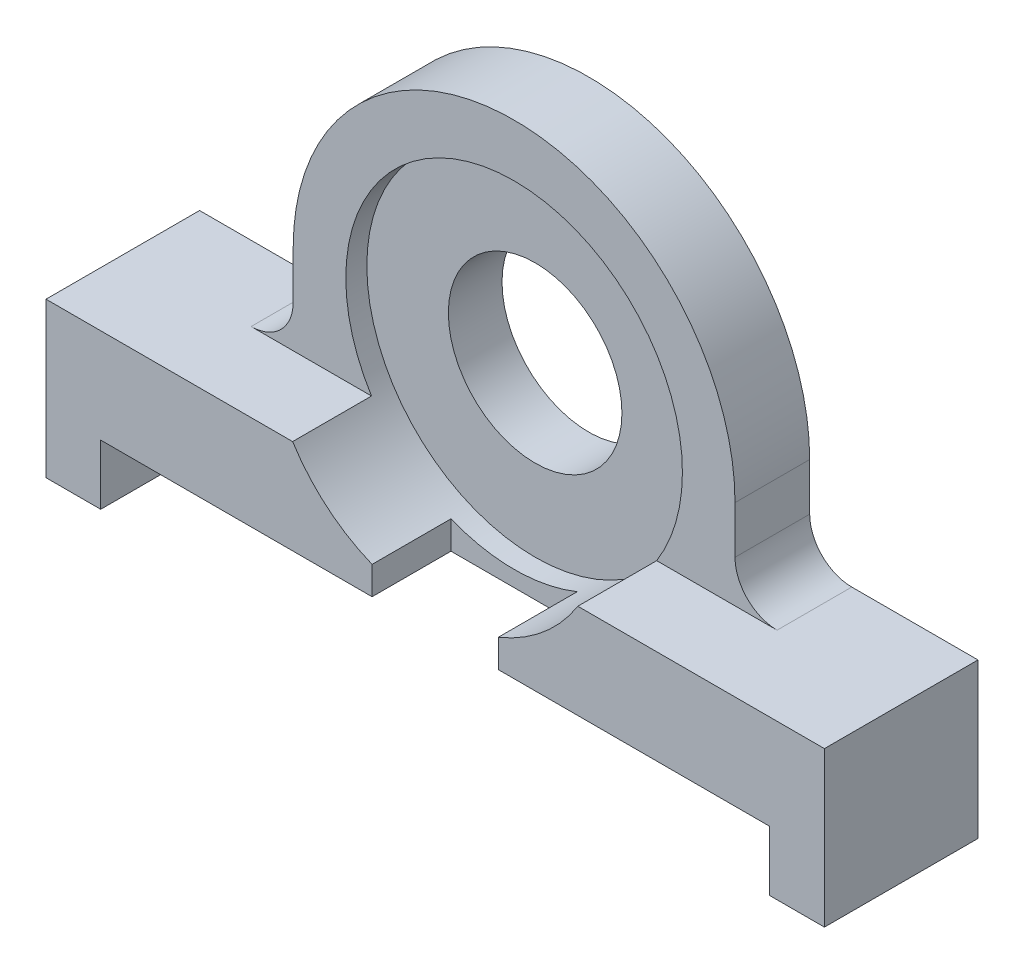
SolidWorks part; units mm, degrees
ref_plane "Front Plane" through (0, 0, 0) normal (0, 0, 1) x (1, 0, 0)
ref_plane "Top Plane" through (0, 0, 0) normal (0, 1, 0) x (1, 0, 0)
ref_plane "Right Plane" through (0, 0, 0) normal (1, 0, 0) x (0, 0, -1)
sketch "Sketch2" plane through (0, 0, 0) normal (0, 0, 1) x (1, 0, 0)
  line L0 (-21, 0) -> (21, 0)
  line L1 (-21, 14.7) -> (-21, 23.2)
  line L2 (21, 23.2) -> (21, 14.7)
  line L3 (21, 14.7) -> (37, 14.7)
  line L4 (37, 14.7) -> (37, 0)
  line L9 (37, 0) -> (21, 0)
  line L10 (0, 9.4378) -> (0, -16.7527) construction
  line L11 (-37, 0) -> (-21, 0)
  line L12 (-37, 14.7) -> (-37, 0)
  line L13 (-21, 14.7) -> (-37, 14.7)
  circle A1 centre (0, 23.2) radius 16
  arc A3 (-21, 23.2) -> (21, 23.2) centre (0, 23.2) cw
  point P2 (0, 44.2)
  point P7 (0, 0)
  point P8 (0, 0.9)
  point P10 (0, 7.2)
  point P12 (0, 39.2)
  dimension "D1" = 32
  dimension "D6" = 23.2
  dimension "D2" = 14.7
  dimension "D3" = 16
  dimension "D5" = 5
extrude "Boss-Extrude1" add sketch "Sketch2" along normal blind 12
sketch "Sketch3" plane through (0, 0, 0) normal (0, 0, 1) x (1, 0, 0)
  circle A1 centre (0, 23.2) radius 8.25
  circle A2 centre (0, 23.2) radius 16 construction
  circle A3 centre (0, 23.2) radius 16
  dimension "D1" = 16.5
extrude "Boss-Extrude2" add sketch "Sketch3" along normal blind 2.5
sketch "Sketch8" plane through (0, 0, 0) normal (0, 0, 1) x (1, 0, 0)
  line L1 (-27, 0) -> (27, 0)
  line L3 (-27, 10.55) -> (27, 10.55)
  line L4 (27, 7.2) -> (27, 10.55)
  line L5 (27, 7.2) -> (34.1, 7.2)
  line L6 (34.1, 7.2) -> (34.1, 0)
  line L7 (-37, 0) -> (37, 0) construction
  line L8 (0, 0) -> (0, 10.55) construction
  line L9 (26.9, 7) -> (33.9, 7) construction
  line L10 (33.9, 0) -> (33.9, 7) construction
  line L11 (24.9, 10.35) -> (-24.9, 10.35) construction
  line L12 (34.1, 0) -> (27, 0)
  line L13 (-34.1, 0) -> (-27, 0)
  line L14 (-34.1, 7.2) -> (-34.1, 0)
  line L15 (-27, 7.2) -> (-34.1, 7.2)
  line L16 (-27, 7.2) -> (-27, 10.55)
  point P6 (0, 10.55)
  dimension "D1" = 54
  dimension "D2" = 0.2
  dimension "D3" = 0.2
  dimension "D4" = 0.2
extrude "Cut-Extrude4" cut sketch "Sketch8" along normal blind 1
sketch "Sketch9" plane through (0, 0, 1) normal (0, 0, -1) x (-1, 0, 0)
  line L0 (-34.1, 0) -> (34.1, 0) construction
  line L1 (21.8, 0) -> (-21.8, 0)
  line L2 (21.8, 0) -> (21.8, 5.7)
  line L3 (21.8, 5.7) -> (-21.8, 5.7)
  line L4 (-21.8, 0) -> (-21.8, 5.7)
  line L5 (-27, 7.2) -> (-27, 10.55) construction
  point P6 (0, 5.7)
  dimension "D1" = 5.2
  dimension "D2" = 5.7
extrude "Cut-Extrude5" cut sketch "Sketch9" against normal up to next
sketch "Sketch10" plane through (0, 0, 0) normal (0, -1, 0) x (1, 0, 0)
  line L0 (-37, 12) -> (-21.8, 12) construction
  line L1 (-37, 12) -> (-37, 0) construction
  line L2 (0, 0) -> (0, 15.6223) construction
  line L3 (-37, 0) -> (-34.1, 0) construction
  circle A0 centre (-34, 9) radius 1.25
  circle A1 centre (-34, 3) radius 1.25
  circle A2 centre (34, 3) radius 1.25
  circle A3 centre (34, 9) radius 1.25
  dimension "D1" = 2.5
  dimension "D4" = 3
  dimension "D2" = 3
  dimension "D3" = 3
extrude "Cut-Extrude6" cut sketch "Sketch10" against normal blind 9
sketch "Sketch11" plane through (0, 0, 12) normal (0, 0, 1) x (1, 0, 0)
  line L0 (21, 14.7) -> (21, 23.2) construction
  line L1 (-21, 23.2) -> (-21, 14.7) construction
  line L2 (21, 14.7) -> (21, 23.2)
  line L3 (-21, 23.2) -> (-21, 14.7)
  line L4 (-21, 14.7) -> (21, 14.7)
  arc A0 (21, 23.2) -> (-21, 23.2) centre (0, 23.2) ccw construction
  arc A1 (21, 23.2) -> (-21, 23.2) centre (0, 23.2) ccw
extrude "Cut-Extrude7" cut sketch "Sketch11" against normal offset from surface (7.5 mm away) 2
fillet "Filete1" radius 2 2 edges at (27, 10.55, 0.5) (-27, 10.55, 0.5)
fillet "Filete2" radius 4 2 edges at (-21, 14.7, 2.25) (21, 14.7, 2.25)
sketch "Sketch12" plane through (0, 0, 12) normal (0, 0, 1) x (1, 0, 0)
  line L0 (21.8, 5.7) -> (-21.8, 5.7) construction
  line L1 (21.8, 0) -> (31.8, 0)
  line L2 (21.8, 0) -> (21.8, 5.7)
  line L3 (21.8, 5.7) -> (31.8, 5.7)
  line L4 (31.8, 0) -> (31.8, 5.7)
  line L5 (0, 0) -> (0, 5.354) construction
  line L6 (-31.8, 0) -> (-31.8, 5.7)
  line L7 (-21.8, 5.7) -> (-31.8, 5.7)
  line L8 (-21.8, 0) -> (-21.8, 5.7)
  line L9 (-21.8, 0) -> (-31.8, 0)
  dimension "D1" = 10
extrude "Cut-Extrude8" cut sketch "Sketch12" against normal blind 7
sketch "Sketch14" plane through (0, 0, 5) normal (0, 0, 1) x (1, 0, 0)
  line L1 (24.8, 1.35) -> (31.8, 1.35)
  line L2 (24.8, 1.35) -> (24.8, 4.35)
  line L3 (24.8, 4.35) -> (31.8, 4.35)
  line L4 (31.8, 1.35) -> (31.8, 4.35)
  line L5 (31.8, 0) -> (31.8, 5.7) construction
  line L6 (31.8, 0) -> (31.8, 5.7) construction
  line L7 (0, 0) -> (0, 5.8267) construction
  line L8 (-31.8, 1.35) -> (-31.8, 4.35)
  line L9 (-24.8, 4.35) -> (-31.8, 4.35)
  line L10 (-24.8, 1.35) -> (-24.8, 4.35)
  line L11 (-24.8, 1.35) -> (-31.8, 1.35)
  point P8 (31.8, 2.85)
  point P9 (-31.8, 2.85)
  dimension "D1" = 3
  dimension "D2" = 7
extrude "Cut-Extrude9" [suppressed] cut sketch "Sketch14" against normal blind 1.5
fillet "Fillet1" [suppressed] radius 1.5
sketch "Sketch15" plane through (0, 0, 12) normal (0, 0, 1) x (1, 0, 0)
  line L0 (31.8, 5.7) -> (-31.8, 5.7) construction
  line L1 (-6, 5.7) -> (6, 5.7)
  line L2 (-6, 5.7) -> (-6, 8.3676)
  line L3 (-6, 8.3676) -> (6, 8.3676)
  line L4 (6, 5.7) -> (6, 8.3676)
  arc A0 (-13.5554, 14.7) -> (13.5554, 14.7) centre (0, 23.2) ccw construction
  point P6 (0, 8.3676)
  dimension "D1" = 12
extrude "Cut-Extrude10" cut sketch "Sketch15" against normal up to surface (7.5 mm away)
sketch "Sketch16" plane through (0, 0, 0) normal (0, 0, -1) x (-1, 0, 0)
  line L1 (-37, 0) -> (-37, 14.7) construction
  line L3 (-25, 10.55) -> (25, 10.55) construction
  line L4 (-37, 14.7) -> (-25, 14.7)
  line L5 (-34.1, 0) -> (-37, 0) construction
  line L6 (-34.1, 0) -> (-34.1, 7.2) construction
  line L7 (-34.1, 7.2) -> (-27, 7.2) construction
  line L8 (-27, 7.2) -> (-27, 8.55) construction
  line L9 (27, 8.55) -> (27, 7.2) construction
  line L10 (27, 7.2) -> (34.1, 7.2) construction
  line L11 (34.1, 7.2) -> (34.1, 0) construction
  line L12 (37, 0) -> (34.1, 0) construction
  line L13 (37, 0) -> (34.1, 0)
  line L14 (34.1, 7.2) -> (34.1, 0)
  line L15 (27, 7.2) -> (34.1, 7.2)
  line L16 (27, 8.55) -> (27, 7.2)
  line L17 (-25, 10.55) -> (25, 10.55)
  line L18 (-27, 7.2) -> (-27, 8.55)
  line L19 (-34.1, 7.2) -> (-27, 7.2)
  line L20 (-34.1, 0) -> (-34.1, 7.2)
  line L21 (-34.1, 0) -> (-37, 0)
  line L22 (-37, 14.7) -> (-37, 0)
  line L23 (37, 14.7) -> (37, 0)
  line L24 (25, 14.7) -> (37, 14.7) construction
  line L25 (21, 23.2) -> (21, 18.7) construction
  line L26 (-21, 18.7) -> (-21, 23.2) construction
  line L27 (25, 14.7) -> (37, 14.7)
  line L28 (21, 23.2) -> (21, 18.7)
  line L29 (-21, 18.7) -> (-21, 23.2)
  arc A0 (-25, 10.55) -> (-27, 8.55) centre (-25, 8.55) ccw construction
  arc A1 (27, 8.55) -> (25, 10.55) centre (25, 8.55) ccw construction
  arc A2 (27, 8.55) -> (25, 10.55) centre (25, 8.55) ccw
  arc A3 (-25, 10.55) -> (-27, 8.55) centre (-25, 8.55) ccw
  arc A4 (21, 18.7) -> (25, 14.7) centre (25, 18.7) ccw construction
  arc A5 (21, 23.2) -> (-21, 23.2) centre (0, 23.2) ccw construction
  arc A6 (-25, 14.7) -> (-21, 18.7) centre (-25, 18.7) ccw construction
  arc A7 (21, 18.7) -> (25, 14.7) centre (25, 18.7) ccw
  arc A8 (21, 23.2) -> (-21, 23.2) centre (0, 23.2) ccw
  arc A9 (-25, 14.7) -> (-21, 18.7) centre (-25, 18.7) ccw
  circle A10 centre (0, 23.2) radius 8.25 construction
  circle A11 centre (0, 23.2) radius 8.25
extrude "Boss-Extrude3" add sketch "Sketch16" along normal blind 2.6
